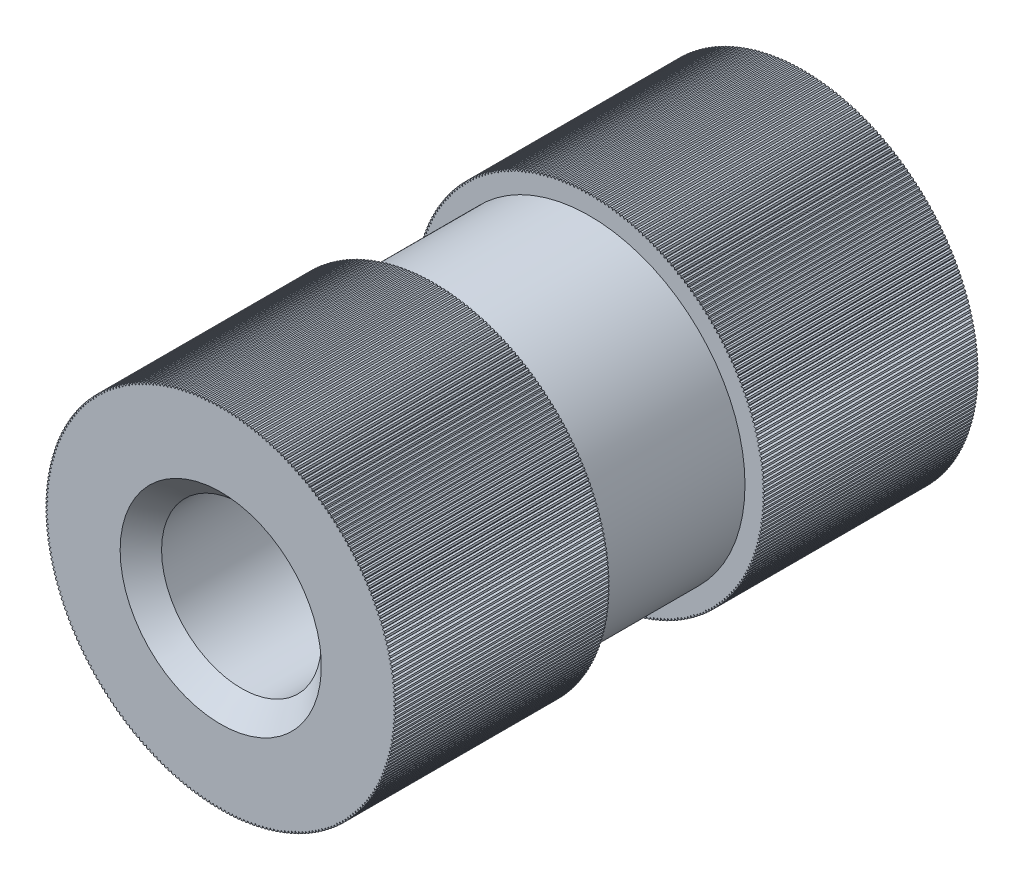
SolidWorks part; units mm, degrees
ref_plane "Front" through (0, 0, 0) normal (0, 0, 1) x (1, 0, 0)
ref_plane "Top" through (0, 0, 0) normal (0, 1, 0) x (1, 0, 0)
ref_plane "Right" through (0, 0, 0) normal (1, 0, 0) x (0, 0, -1)
sketch "Sketch1" plane through (0, -9.768, 0.768) normal (1, 0, 0) x (0, 1, 0)
  line L0 (9.768, 37.6566) -> (9.768, -48.1926) construction
  line L1 (9.768, -30.768) -> (18.768, -30.768)
  line L2 (18.768, -30.768) -> (18.768, -19.768)
  line L3 (18.768, -19.768) -> (17.768, -19.768)
  line L4 (17.768, -19.768) -> (17.768, -11.768)
  line L5 (17.768, -11.768) -> (18.768, -11.768)
  line L6 (18.768, -11.768) -> (18.768, -0.768)
  line L7 (18.768, -0.768) -> (9.768, -0.768)
  line L8 (9.768, -0.768) -> (9.768, -30.768)
  dimension "c" = 8
  dimension "m" = 30
  dimension "d1" = 16
  dimension "dk" = 18
revolve "BaseNut" add sketch "Sketch1" angle 360 about L0
sketch "Sketch2" plane through (1.9825, 2.876, -30) normal (0, 0, -1) x (-1, 0, 0)
  circle A0 centre (1.9825, -2.876) radius 4.1149
  circle A1 centre (1.9825, -2.876) radius 9 construction
  dimension "D1" = 8.2299
extrude "Hole" cut sketch "Sketch2" against normal through all
chamfer "EndChamfer" distance 1.0667 angle 45 2 edges at (-4.1149, 0, 0) (-4.1149, 0, -30)
sketch "Sketch3" plane through (0, 0, 0) normal (0, 0, 1) x (1, 0, 0)
  line L0 (0, 0) -> (0, 15.979) construction
  line L1 (0, 9) -> (-0.1, 9) construction
  line L2 (0, 8.9) -> (0.0866, 9.05)
  line L3 (0.0866, 9.05) -> (-0.0866, 9.05)
  line L4 (-0.0866, 9.05) -> (0, 8.9)
  line L5 (-0.1, 9) -> (-0.1, 8.9) construction
  line L6 (-0.1, 8.9) -> (0, 8.9) construction
  circle A0 centre (0, 9) radius 0.1 construction
  circle A2 centre (0, 0) radius 9 construction
  dimension "D3" = 0.1
  dimension "D1" = 0.1
extrude "Cut-Extrude1" cut sketch "Sketch3" against normal through all
pattern_circular "CirPattern1" count 282 over 360 about axis through (0, 0, 0) along (0, 0, 1) of "Cut-Extrude1"
sketch "Sketch4" plane through (0, 0, 0) normal (0, 1, 0) x (1, 0, 0)
  line L0 (3.2299, 29.3759) -> (4.1149, 29.3759)
  line L1 (4.1149, 29.3759) -> (4.8814, 28.9333)
  line L2 (4.8814, 28.9333) -> (4.1149, 28.4908)
  line L3 (4.1149, 28.4908) -> (3.2299, 28.4908)
  line L4 (3.2299, 28.4908) -> (3.2299, 29.3759)
  line L6 (4.1149, 28.9333) -> (-4.1149, 28.9333) construction
  line L7 (0, 33.7411) -> (0, 12.4768) construction
  dimension "D1" = 0.8851
  dimension "D2" = 8.2299
revolve "Cut-Revolve10" [suppressed] cut sketch "Sketch4" angle 360 about L7
pattern_linear "LPattern10" [suppressed] count 27 spacing 1.0621 along (0, 0, -1)
equation "\"D3@Sketch3\" = \"dk@Sketch1\" / 100"
equation "\"D3@Sketch3\" = \"D3@Sketch3\" "
equation "\"D1@CirPattern1\" =  int( \"dk@Sketch1\" * PI / 0.5 + 1  ) "
equation "\"D1@CirPattern1\" = int ( 3.14 / atn ( 2 * \"D3@Sketch3\" / \"dk@Sketch1\" )  )"
equation "\"D1@EndChamfer\" = \"d1@Sketch1\" / 15"
equation "\"D1@Sketch4\" = (  \"D2@ThreadCosmetic1\" - \"D1@Sketch2\" )  / 2"
equation "\"D2@Sketch4\" = \"D1@Sketch2\""
equation "\"D3@LPattern10\" = \"D1@Sketch4\" * 1.2"
equation "\"D1@LPattern10\" = \"m@Sketch1\" / \"D3@LPattern10\"-1"
